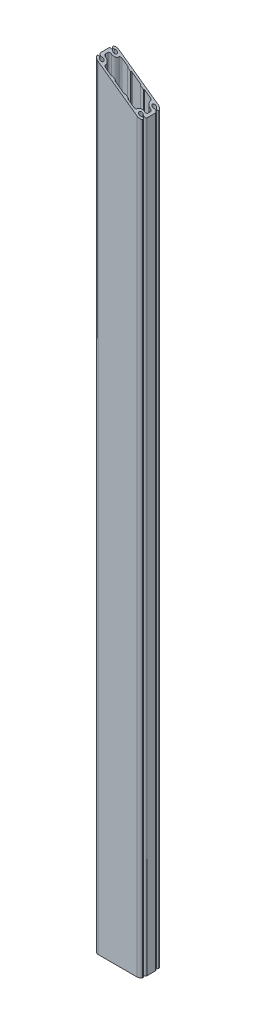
SolidWorks part; units mm, degrees
ref_plane "Alzado" through (0, 0, 0) normal (0, 0, 1) x (1, 0, 0)
ref_plane "Planta" through (0, 0, 0) normal (0, 1, 0) x (1, 0, 0)
ref_plane "Vista lateral" through (0, 0, 0) normal (1, 0, 0) x (0, 0, -1)
sketch "Croquis2" plane through (0, 0, 0) normal (0, 1, 0) x (1, 0, 0)
  line L0 (-183.2758, 0) -> (156.0252, 0) construction
  line L1 (0, 113.0945) -> (0, -113.0945) construction
  line L2 (90, -15.8204) -> (90, 15.8204)
  line L3 (75.5, 40) -> (-75.5, 40)
  line L4 (-17.4827, 32) -> (17.4827, 32)
  line L5 (20, 29) -> (30, 29)
  line L6 (123.5786, 25.5) -> (27.4214, 25.5) construction
  line L7 (75.5, 71.4027) -> (75.5, -20.4027) construction
  line L8 (82, 4.5) -> (82, -4.5)
  line L9 (20, 29) -> (17.4827, 32)
  line L10 (30, 29) -> (32.5173, 32)
  line L11 (32.5173, 32) -> (54.5, 32)
  line L12 (75.5, -71.4027) -> (75.5, 20.4027) construction
  line L13 (123.5786, -25.5) -> (27.4214, -25.5) construction
  line L14 (32.5173, -32) -> (54.5, -32)
  line L15 (30, -29) -> (32.5173, -32)
  line L16 (20, -29) -> (17.4827, -32)
  line L17 (20, -29) -> (30, -29)
  line L18 (-17.4827, -32) -> (17.4827, -32)
  line L19 (75.5, -40) -> (-75.5, -40)
  line L20 (-123.5786, -25.5) -> (-27.4214, -25.5) construction
  line L21 (-75.5, -71.4027) -> (-75.5, 20.4027) construction
  line L22 (-75.5, 71.4027) -> (-75.5, -20.4027) construction
  line L23 (-123.5786, 25.5) -> (-27.4214, 25.5) construction
  line L24 (-20, -29) -> (-30, -29)
  line L25 (-20, -29) -> (-17.4827, -32)
  line L26 (-30, -29) -> (-32.5173, -32)
  line L27 (-32.5173, -32) -> (-54.5, -32)
  line L28 (-32.5173, 32) -> (-54.5, 32)
  line L29 (-30, 29) -> (-32.5173, 32)
  line L30 (-20, 29) -> (-17.4827, 32)
  line L31 (-82, 4.5) -> (-82, -4.5)
  line L32 (-20, 29) -> (-30, 29)
  line L33 (-90, -15.8204) -> (-90, 15.8204)
  arc A0 (88.1963, 32.5039) -> (75.5, 40) centre (75.5, 25.5) ccw
  arc A1 (81.1914, 28.6397) -> (79.722, 20.5579) centre (75.5, 25.5) ccw
  arc A3 (61, 25.5) -> (54.5, 32) centre (54.5, 25.5) ccw
  arc A4 (81.1914, 28.6397) -> (88.1963, 32.5039) centre (84.6939, 30.5718) ccw
  arc A5 (90, 15.8204) -> (79.722, 20.5579) centre (83.7692, 15.8204) ccw
  arc A6 (82, 4.5) -> (75.5, 11) centre (75.5, 4.5) ccw
  arc A7 (61, 25.5) -> (75.5, 11) centre (75.5, 25.5) ccw
  arc A8 (61, -25.5) -> (75.5, -11) centre (75.5, -25.5) cw
  arc A9 (82, -4.5) -> (75.5, -11) centre (75.5, -4.5) cw
  arc A10 (90, -15.8204) -> (79.722, -20.5579) centre (83.7692, -15.8204) cw
  arc A11 (81.1914, -28.6397) -> (88.1963, -32.5039) centre (84.6939, -30.5718) cw
  arc A12 (61, -25.5) -> (54.5, -32) centre (54.5, -25.5) cw
  arc A13 (81.1914, -28.6397) -> (79.722, -20.5579) centre (75.5, -25.5) cw
  arc A14 (88.1963, -32.5039) -> (75.5, -40) centre (75.5, -25.5) cw
  arc A15 (-88.1963, -32.5039) -> (-75.5, -40) centre (-75.5, -25.5) ccw
  arc A16 (-81.1914, -28.6397) -> (-79.722, -20.5579) centre (-75.5, -25.5) ccw
  arc A17 (-61, -25.5) -> (-54.5, -32) centre (-54.5, -25.5) ccw
  arc A18 (-81.1914, -28.6397) -> (-88.1963, -32.5039) centre (-84.6939, -30.5718) ccw
  arc A19 (-90, -15.8204) -> (-79.722, -20.5579) centre (-83.7692, -15.8204) ccw
  arc A20 (-82, -4.5) -> (-75.5, -11) centre (-75.5, -4.5) ccw
  arc A21 (-61, -25.5) -> (-75.5, -11) centre (-75.5, -25.5) ccw
  arc A22 (-61, 25.5) -> (-75.5, 11) centre (-75.5, 25.5) cw
  arc A23 (-82, 4.5) -> (-75.5, 11) centre (-75.5, 4.5) cw
  arc A24 (-90, 15.8204) -> (-79.722, 20.5579) centre (-83.7692, 15.8204) cw
  arc A25 (-81.1914, 28.6397) -> (-88.1963, 32.5039) centre (-84.6939, 30.5718) cw
  arc A26 (-61, 25.5) -> (-54.5, 32) centre (-54.5, 25.5) cw
  arc A27 (-81.1914, 28.6397) -> (-79.722, 20.5579) centre (-75.5, 25.5) cw
  arc A28 (-88.1963, 32.5039) -> (-75.5, 40) centre (-75.5, 25.5) cw
  point P6 (0, 0)
  point P8 (-90, 0)
  point P9 (0, 40)
  point P17 (75.5, 25.5)
  point P20 (75.5, 25.5)
  point P56 (82, 0)
  point P58 (90, 0)
  point P94 (0, -40)
  point P95 (0, -32)
  point P102 (0, 32)
  point P103 (-82, 0)
  dimension "D5" = 14.5
  dimension "D6" = 6.5
  dimension "D7" = 6.2308
  dimension "D8" = 9.1939
  dimension "D1" = 90
  dimension "D2" = 40
  dimension "D3" = 8
  dimension "D4" = 8
  dimension "D9" = 21
  dimension "D10" = 10
  dimension "D11" = 20
  dimension "D12" = 3
  dimension "D13" = 50
  dimension "D14" = 50
extrude "Saliente-Extruir1" add sketch "Croquis2" along normal blind 3000
sketch "Croquis3" plane through (0, 0, 40) normal (0, 0, 1) x (1, 0, 0)
  line L0 (-90, 3000) -> (-90, 2921.7525) construction
  line L1 (-90, 3000) -> (256.4753, 3000) construction
  line L2 (90, 2871.8914) -> (326.9853, 2871.8914) construction
  line L3 (90, 3000) -> (90, 2871.8914)
  line L4 (90, 3000) -> (90, 0) construction
  line L7 (90, 2871.8914) -> (-90, 3000)
  line L8 (-90, 3000) -> (-90, 0) construction
  line L9 (90, 3000) -> (-90, 3000)
  dimension "D1" = 144.56
extrude "Cortar-Extruir1" cut sketch "Croquis3" against normal through all
